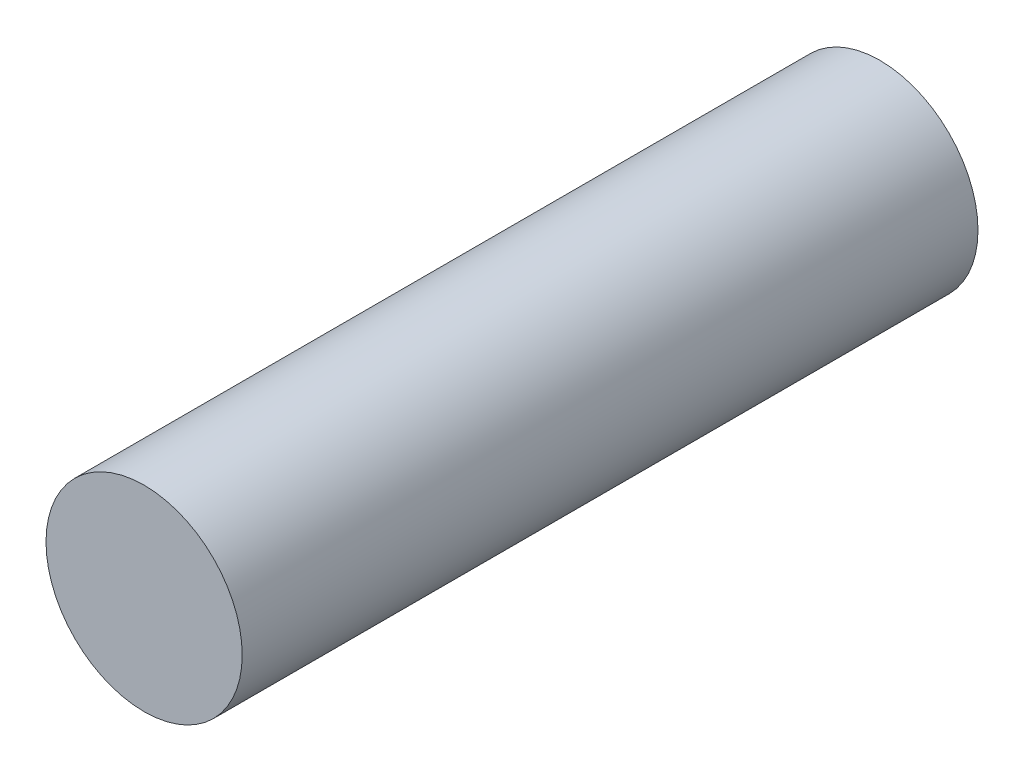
SolidWorks part; units mm, degrees
ref_plane "Front Plane" through (0, 0, 0) normal (0, 0, 1) x (1, 0, 0)
ref_plane "Top Plane" through (0, 0, 0) normal (0, 1, 0) x (1, 0, 0)
ref_plane "Right Plane" through (0, 0, 0) normal (1, 0, 0) x (0, 0, -1)
sketch "Sketch2" plane through (0, 0, 0) normal (0, 0, 1) x (1, 0, 0)
  circle A0 centre (0, 0) radius 20
  dimension "D1" = 40
extrude "Boss-Extrude1" add sketch "Sketch2" along normal mid plane 150
